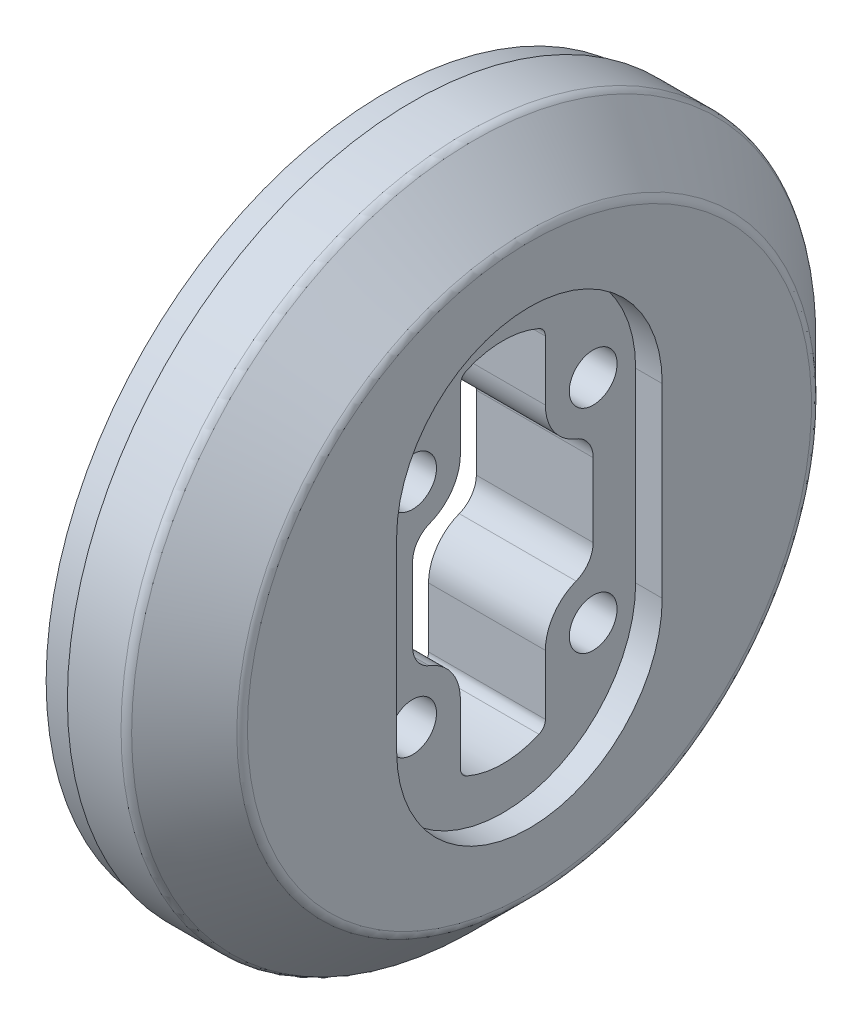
SolidWorks part; units mm, degrees
ref_plane "Vorderansicht" through (0, 0, 0) normal (0, 0, 1) x (1, 0, 0)
ref_plane "Draufsicht" through (0, 0, 0) normal (0, 1, 0) x (1, 0, 0)
ref_plane "Seitenansicht" through (0, 0, 0) normal (1, 0, 0) x (0, 0, -1)
sketch "Skizze1" plane through (0, 0, 0) normal (0, 0, 1) x (1, 0, 0)
  line L0 (-23.9525, 0) -> (135.8233, 0) construction
  line L1 (0, 0) -> (0, 64)
  line L2 (0, 64) -> (5, 64)
  line L3 (5, 64) -> (5, 65)
  line L4 (5, 65) -> (15.1, 65)
  line L5 (16.5142, 64.4142) -> (26.4142, 54.5142)
  line L6 (27, 0) -> (0, 0)
  line L7 (27, 53.1) -> (27, 0)
  arc A0 (15.1, 65) -> (16.5142, 64.4142) centre (15.1, 63) cw
  arc A1 (26.4142, 54.5142) -> (27, 53.1) centre (25, 53.1) cw
  dimension "D3" = 2
  dimension "D1" = 130
  dimension "D2" = 22
  dimension "D4" = 10.1
  dimension "D5" = 45
  dimension "D6" = 128
  dimension "D7" = 5
revolve "Rotation1" add sketch "Skizze1" angle 360 about L0
sketch "Skizze2" plane through (27, 0, 0) normal (1, 0, 0) x (0, 0, -1)
  line L0 (-25, 17.5) -> (-25, -17.5)
  line L1 (25, -17.5) -> (25, 17.5)
  line L2 (0, -42.5) -> (0, 42.5) construction
  line L3 (25, 0) -> (-25, 0) construction
  line L4 (0, 34.4999) -> (0, -34.5001) construction
  circle A0 centre (-17, 20) radius 4.5
  arc A1 (25, 17.5) -> (-25, 17.5) centre (0, 17.5) ccw
  circle A2 centre (17, 20) radius 4.5
  circle A3 centre (-17, -20) radius 4.5
  arc A4 (-25, -17.5) -> (25, -17.5) centre (0, -17.5) ccw
  circle A5 centre (17, -20) radius 4.5
  dimension "D1" = 9
  dimension "D2" = 25
  dimension "D3" = 85
  dimension "D4" = 34
  dimension "D5" = 40
extrude "Schnitt-Linear austragen1" cut sketch "Skizze2" against normal blind 5
sketch "Skizze3" plane through (27, 0, 0) normal (1, 0, 0) x (0, 0, -1)
  circle A1 centre (17, 20) radius 4.5
  circle A2 centre (17, 20) radius 4.5
  circle A3 centre (-17, 20) radius 4.5
  circle A4 centre (-17, 20) radius 4.5
  circle A5 centre (-17, -20) radius 4.5
  circle A6 centre (-17, -20) radius 4.5
  circle A7 centre (17, -20) radius 4.5
  circle A8 centre (17, -20) radius 4.5
  dimension "D1" = 0
  dimension "D2" = 0
  dimension "D3" = 0
  dimension "D4" = 0
extrude "Schnitt-Linear austragen2" cut sketch "Skizze3" against normal through all
sketch "Skizze4" plane through (22, 0, 0) normal (1, 0, 0) x (0, 0, -1)
  line L0 (8, -31.2479) -> (8, -20)
  line L1 (-8, -20) -> (-8, -31.2479)
  line L2 (8, 20) -> (8, 31.2476)
  line L3 (17, -6.9233) -> (17, 6.9233)
  line L4 (-8, 31.2476) -> (-8, 20)
  line L5 (-17, 6.9365) -> (-17, -6.9365)
  line L6 (-17, 0) -> (17, 0) construction
  line L7 (0, -34.5001) -> (0, 34.4999) construction
  line L8 (25, -17.5) -> (25, 17.5) construction
  arc A0 (13.7857, -11.5935) -> (8, -20) centre (17, -20) ccw
  arc A1 (-8, -20) -> (-13.88, -11.5581) centre (-17, -20) ccw
  arc A2 (6.8, -33.0809) -> (8, -31.2479) centre (6, -31.2479) ccw
  arc A3 (-6.8, -33.0809) -> (6.8, -33.0809) centre (0, -17.5001) ccw
  arc A4 (-8, -31.2479) -> (-6.8, -33.0809) centre (-6, -31.2479) ccw
  arc A5 (-17, -6.9365) -> (-13.88, -11.5581) centre (-12, -6.925) ccw
  arc A6 (-13.88, 11.5581) -> (-17, 6.9365) centre (-12, 6.925) ccw
  arc A7 (8, 31.2476) -> (6.8, 33.0806) centre (6, 31.2476) ccw
  arc A8 (8, 20) -> (13.7857, 11.5935) centre (17, 20) ccw
  arc A9 (17, 6.9233) -> (13.7857, 11.5935) centre (12, 6.9233) ccw
  arc A10 (13.7857, -11.5935) -> (17, -6.9233) centre (12, -6.9233) ccw
  arc A11 (-13.88, 11.5581) -> (-8, 20) centre (-17, 20) ccw
  arc A12 (-6.8, 33.0806) -> (-8, 31.2476) centre (-6, 31.2476) ccw
  arc A13 (6.8, 33.0806) -> (-6.8, 33.0806) centre (0, 17.4999) ccw
  point P42 (-89.4585, 22.9845)
  dimension "D3" = 2
  dimension "D4" = 5
  dimension "D5" = 9
  dimension "D9" = 37
  dimension "D1" = 34
  dimension "D2" = 16
  dimension "D6" = 40
  dimension "D7" = 62.4955
  dimension "D10" = 38.88
extrude "Schnitt-Linear austragen3" cut sketch "Skizze4" against normal through all
